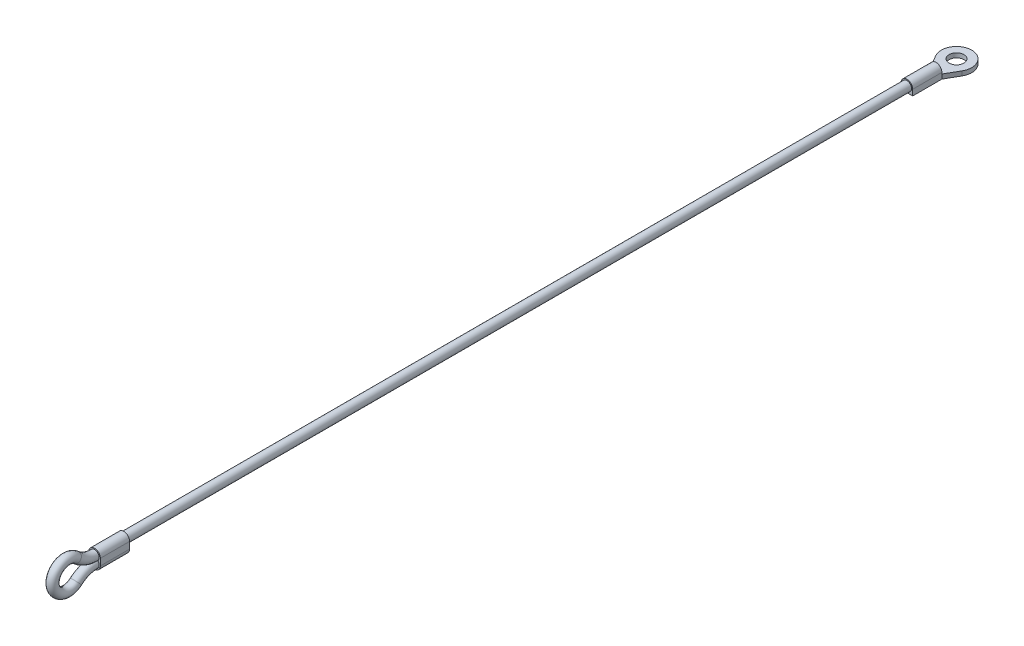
SolidWorks part; units mm, degrees
ref_plane "Front Plane" through (0, 0, 0) normal (0, 0, 1) x (1, 0, 0)
ref_plane "Top Plane" through (0, 0, 0) normal (0, 1, 0) x (1, 0, 0)
ref_plane "Right Plane" through (0, 0, 0) normal (1, 0, 0) x (0, 0, -1)
sketch "Sketch1" plane through (0, 0, 0) normal (1, 0, 0) x (0, 0, -1)
  line L2 (-278.2, 0) -> (0, 0)
  arc A0 (-278.2, 0) -> (-284.6, 2.4446) centre (-278.2, 9.6) cw
  arc A1 (-284.6, 2.4446) -> (-284.6, -4.7108) centre (-287.8, -1.1331) ccw
  arc A2 (-284.6, -4.7108) -> (-278.2, -2.2663) centre (-278.2, -11.8663) cw
  dimension "D1" = 4.8
  dimension "D4" = 9.6
  dimension "D2" = 287.8
  dimension "D3" = 9.6
sketch "Sketch2" plane through (0, 0, 0) normal (0, 0, 1) x (1, 0, 0)
  circle A0 centre (0, 0) radius 1.59
  dimension "D1" = 3.18
sweep "Sweep1" add profiles "Sketch2" path "Sketch1"
sketch "Sketch3" plane through (0, 0, 278.2) normal (0, 0, -1) x (-1, 0, 0)
  line L0 (0, 0) -> (0, -2.2663) construction
  line L1 (1.99, 0) -> (1.99, -2.2663)
  line L2 (-1.99, 0) -> (-1.99, -2.2663)
  line L3 (-1.59, -2.2663) -> (1.59, -2.2663) construction
  arc A0 (1.99, 0) -> (-1.99, 0) centre (0, 0) ccw
  arc A1 (-1.99, -2.2663) -> (1.99, -2.2663) centre (0, -2.2663) ccw
  point P3 (0, -1.1331)
  dimension "D1" = 3.98
extrude "Boss-Extrude1" add sketch "Sketch3" along normal blind 10
sketch "Sketch4" plane through (0, 0, 0) normal (0, 0, -1) x (-1, 0, 0)
  line L0 (-1.99, 0) -> (-1.99, -1.99)
  line L1 (-1.99, -1.99) -> (0, -1.99)
  line L2 (0, -1.99) -> (1.99, -1.99)
  line L3 (1.99, -1.99) -> (1.99, 0)
  arc A0 (1.99, 0) -> (-1.99, 0) centre (0, 0) ccw
  dimension "D1" = 3.98
extrude "Boss-Extrude2" add sketch "Sketch4" along normal blind 10
sketch "Sketch5" plane through (0, -1.99, 0) normal (0, -1, 0) x (1, 0, 0)
  line L0 (-1.99, -10) -> (1.99, -10)
  line L1 (1.99, -10) -> (4.5171, -14.4138)
  line L2 (-4.5171, -14.4138) -> (-1.99, -10)
  arc A0 (4.5171, -14.4138) -> (-4.5171, -14.4138) centre (0, -17) cw
  circle A1 centre (0, -17) radius 2.54
  point P8 (-5.205, -17)
  point P9 (5.205, -17)
  dimension "D1" = 5.08
  dimension "D2" = 10.41
  dimension "D3" = 17
extrude "Boss-Extrude3" add sketch "Sketch5" against normal blind 1.52
